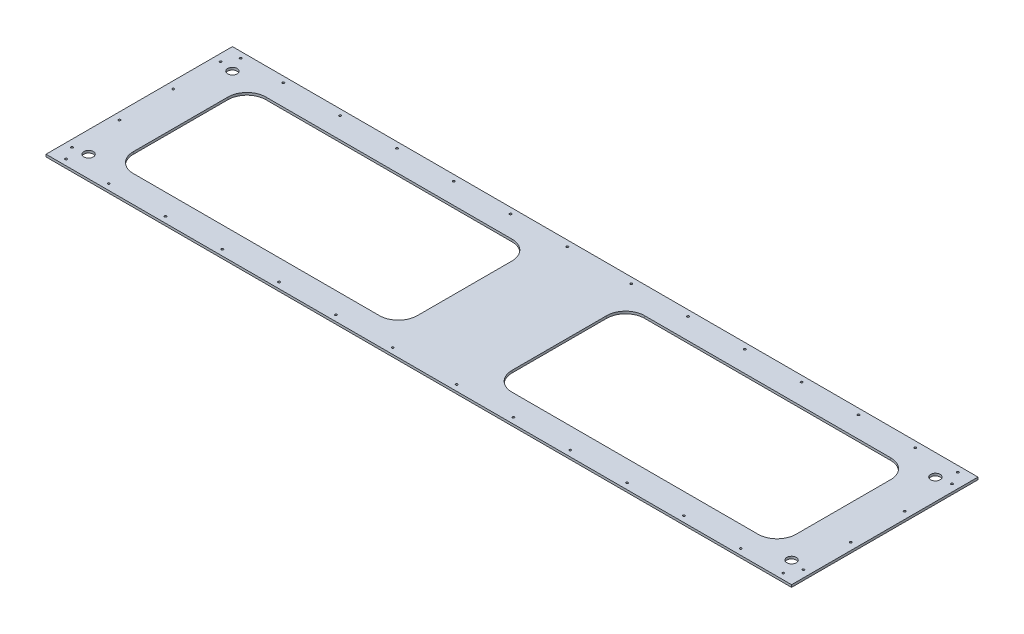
SolidWorks part; units mm, degrees
ref_plane "Front Plane" through (0, 0, 0) normal (0, 0, 1) x (1, 0, 0)
ref_plane "Top Plane" through (0, 0, 0) normal (0, 1, 0) x (1, 0, 0)
ref_plane "Right Plane" through (0, 0, 0) normal (1, 0, 0) x (0, 0, -1)
sketch "Sketch1" plane through (0, 0, 0) normal (0, 1, 0) x (1, 0, 0)
  line L1 (0, 0) -> (2000.25, 0)
  line L2 (0, 0) -> (0, 500.126)
  line L3 (0, 500.126) -> (2000.25, 500.126)
  line L4 (2000.25, 0) -> (2000.25, 500.126)
  dimension "D1" = 2000.25
  dimension "D2" = 500.126
extrude "Boss-Extrude1" add sketch "Sketch1" along normal blind 6.35
sketch "Sketch2" plane through (0, 6.35, 0) normal (0, 1, 0) x (1, 0, 0)
  line L0 (2000.25, 509.651) -> (0, 509.651) construction
  line L1 (19.05, 484.251) -> (1981.2, 484.251) construction
  line L2 (19.05, 484.251) -> (19.05, 15.875) construction
  line L3 (19.05, 15.875) -> (1981.2, 15.875) construction
  line L4 (1981.2, 484.251) -> (1981.2, 15.875) construction
  line L5 (2000.25, -9.525) -> (0, -9.525) construction
  line L6 (0, 500.126) -> (0, 0) construction
  line L7 (2000.25, 0) -> (2000.25, 500.126) construction
  line L8 (0, 0) -> (2000.25, 0) construction
  line L9 (1000.125, 500.126) -> (1000.125, -201.0715) construction
  line L10 (2000.25, 500.126) -> (0, 500.126) construction
  line L11 (0, 250.063) -> (131.7707, 250.063) construction
  line L12 (19.05, 15.875) -> (1981.2, 15.875) construction
  circle A36 centre (1962.15, 15.875) radius 2.8067
  circle A37 centre (1847.85, 15.875) radius 2.8067
  circle A38 centre (1981.2, 50.8) radius 2.8067
  circle A39 centre (1695.45, 15.875) radius 2.8067
  circle A40 centre (1543.05, 15.875) radius 2.8067
  circle A41 centre (1390.65, 15.875) radius 2.8067
  circle A42 centre (1238.25, 15.875) radius 2.8067
  circle A43 centre (1085.85, 15.875) radius 2.8067
  circle A44 centre (914.4, 15.875) radius 2.8067
  circle A45 centre (762, 15.875) radius 2.8067
  circle A46 centre (609.6, 15.875) radius 2.8067
  circle A47 centre (457.2, 15.875) radius 2.8067
  circle A48 centre (304.8, 15.875) radius 2.8067
  circle A49 centre (152.4, 15.875) radius 2.8067
  circle A50 centre (38.1, 15.875) radius 2.8067
  circle A51 centre (19.05, 50.8) radius 2.8067
  circle A52 centre (19.05, 177.8) radius 2.8067
  circle A53 centre (19.05, 322.326) radius 2.8067
  circle A54 centre (19.05, 449.326) radius 2.8067
  circle A55 centre (38.1, 484.251) radius 2.8067
  circle A56 centre (152.4, 484.251) radius 2.8067
  circle A57 centre (304.8, 484.251) radius 2.8067
  circle A58 centre (457.2, 484.251) radius 2.8067
  circle A59 centre (609.6, 484.251) radius 2.8067
  circle A60 centre (762, 484.251) radius 2.8067
  circle A61 centre (914.4, 484.251) radius 2.8067
  circle A62 centre (1085.85, 484.251) radius 2.8067
  circle A63 centre (1238.25, 484.251) radius 2.8067
  circle A64 centre (1390.65, 484.251) radius 2.8067
  circle A65 centre (1543.05, 484.251) radius 2.8067
  circle A66 centre (1695.45, 484.251) radius 2.8067
  circle A67 centre (1847.85, 484.251) radius 2.8067
  circle A68 centre (1962.15, 484.251) radius 2.8067
  circle A69 centre (1981.2, 449.326) radius 2.8067
  circle A70 centre (1981.2, 322.326) radius 2.8067
  circle A71 centre (1981.2, 177.8) radius 2.8067
  dimension "D5" = 50.8
  dimension "D6" = 38.1
  dimension "D11" = 5.6134
  dimension "D1" = 25.4
  dimension "D2" = 25.4
  dimension "D3" = 19.05
  dimension "D4" = 19.05
  dimension "D7" = 449.326
extrude "Cut-Extrude1" cut sketch "Sketch2" against normal through all
sketch "Sketch3" plane through (0, 6.35, 0) normal (0, 1, 0) x (1, 0, 0)
  line L0 (1000.125, 500.126) -> (1000.125, 0) construction
  line L1 (2000.25, 500.126) -> (0, 500.126) construction
  line L2 (0, 0) -> (2000.25, 0) construction
  line L3 (0, 250.063) -> (2000.25, 250.063) construction
  line L4 (0, 500.126) -> (0, 0) construction
  line L5 (2000.25, 0) -> (2000.25, 500.126) construction
  line L6 (111.125, 377.063) -> (111.125, 123.063)
  line L7 (1177.925, 427.863) -> (1838.325, 427.863)
  line L8 (1127.125, 377.063) -> (1127.125, 123.063)
  line L9 (1177.925, 72.263) -> (1838.325, 72.263)
  line L10 (1889.125, 377.063) -> (1889.125, 123.063)
  line L11 (822.325, 72.263) -> (161.925, 72.263)
  line L12 (873.125, 377.063) -> (873.125, 123.063)
  line L13 (822.325, 427.863) -> (161.925, 427.863)
  arc A0 (1127.125, 123.063) -> (1177.925, 72.263) centre (1177.925, 123.063) ccw
  arc A1 (1177.925, 427.863) -> (1127.125, 377.063) centre (1177.925, 377.063) ccw
  arc A2 (1838.325, 72.263) -> (1889.125, 123.063) centre (1838.325, 123.063) ccw
  arc A3 (1838.325, 427.863) -> (1889.125, 377.063) centre (1838.325, 377.063) cw
  arc A4 (161.925, 427.863) -> (111.125, 377.063) centre (161.925, 377.063) ccw
  arc A5 (161.925, 72.263) -> (111.125, 123.063) centre (161.925, 123.063) cw
  arc A6 (822.325, 427.863) -> (873.125, 377.063) centre (822.325, 377.063) cw
  arc A7 (873.125, 123.063) -> (822.325, 72.263) centre (822.325, 123.063) cw
  point P20 (1127.125, 427.863)
  point P23 (1889.125, 72.263)
  point P26 (1889.125, 427.863)
  point P39 (111.125, 427.863)
  point P40 (111.125, 72.263)
  point P41 (873.125, 427.863)
  dimension "D5" = 50.8
  dimension "D1" = 762
  dimension "D2" = 177.8
  dimension "D3" = 355.6
  dimension "D4" = 127
extrude "Cut-Extrude2" cut sketch "Sketch3" against normal through all
sketch "Sketch4" plane through (0, 6.35, 0) normal (0, 1, 0) x (1, 0, 0)
  line L0 (1937.1894, 30.988) -> (43.3764, 30.988) construction
  line L1 (1508.125, 472.4327) -> (1508.125, 26.7402) construction
  line L2 (492.125, 472.4327) -> (492.125, 26.7402) construction
  circle A0 centre (1381.125, 30.988) radius 2.8067
  circle A1 centre (365.125, 30.988) radius 2.8067
  circle A3 centre (415.925, 30.988) radius 2.8067
  circle A4 centre (466.725, 30.988) radius 2.8067
  circle A5 centre (517.525, 30.988) radius 2.8067
  circle A10 centre (1431.925, 30.988) radius 2.8067
  circle A11 centre (1482.725, 30.988) radius 2.8067
  circle A12 centre (1533.525, 30.988) radius 2.8067
  circle A13 centre (1584.325, 30.988) radius 2.8067
  circle A14 centre (1635.125, 30.988) radius 2.8067
  circle A15 centre (568.325, 30.988) radius 2.8067
  circle A16 centre (619.125, 30.988) radius 2.8067
  dimension "D1" = 5.6134
  dimension "D2" = 5.6134
extrude "Cut-Extrude3" [suppressed] cut sketch "Sketch4" against normal through all
sketch "Sketch6" [suppressed] plane through (0, 9.525, 0) normal (0, 1, 0) x (1, 0, 0)
  line L0 (2000.25, 250.063) -> (873.125, 250.063) construction
  line L1 (2000.25, 0) -> (2000.25, 500.126) construction
  line L2 (873.125, 123.063) -> (873.125, 377.063) construction
  line L3 (1000.125, 500.126) -> (1000.125, 0) construction
  line L4 (2000.25, 500.126) -> (0, 500.126) construction
  line L5 (0, 0) -> (2000.25, 0) construction
  line L6 (994.6257, 326.517) -> (931.1643, 216.5985)
  line L7 (936.6635, 207.0735) -> (1063.5865, 207.0735)
  line L8 (1069.0857, 216.5985) -> (1005.6243, 326.517)
  line L9 (1037.355, 271.5577) -> (886.5209, 184.4736) construction
  line L10 (962.895, 271.5577) -> (1094.4398, 195.6103) construction
  arc A0 (994.6257, 326.517) -> (1005.6243, 326.517) centre (1000.125, 323.342) cw
  arc A1 (931.1643, 216.5985) -> (936.6635, 207.0735) centre (936.6635, 213.4235) ccw
  arc A2 (1063.5865, 207.0735) -> (1069.0857, 216.5985) centre (1063.5865, 213.4235) ccw
  dimension "D1" = 6.35
extrude "Cut-Extrude4" [suppressed] cut sketch "Sketch6" against normal through all
sketch "Sketch7" plane through (0, 6.35, 0) normal (0, 1, 0) x (1, 0, 0)
  line L0 (1000.125, 0) -> (1000.125, 310.9091) construction
  line L1 (0, 0) -> (2000.25, 0) construction
  line L2 (0, 500.126) -> (0, 0) construction
  line L3 (2000.25, 500.126) -> (0, 500.126) construction
  circle A0 centre (57.15, 442.976) radius 12.7
  circle A1 centre (57.15, 57.15) radius 12.7
  circle A2 centre (1943.1, 57.15) radius 12.7
  circle A3 centre (1943.1, 442.976) radius 12.7
  dimension "D2" = 25.4
  dimension "D1" = 57.15
  dimension "D3" = 57.15
  dimension "D4" = 57.15
extrude "air bleeds" cut sketch "Sketch7" against normal through all
